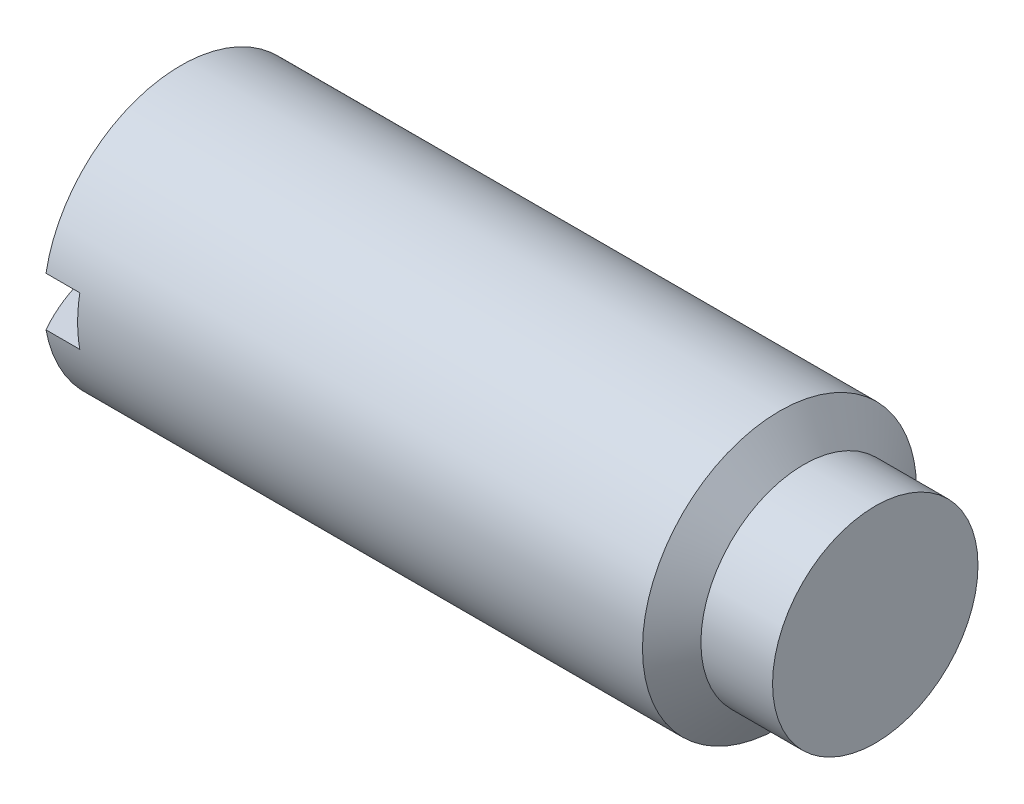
SolidWorks part; units mm, degrees
ref_plane "Plane1" through (0, 0, 0) normal (0, 0, 1) x (1, 0, 0)
ref_plane "Plane2" through (0, 0, 0) normal (0, 1, 0) x (1, 0, 0)
ref_plane "Plane3" through (0, 0, 0) normal (1, 0, 0) x (0, 0, -1)
sketch "BodySke" plane through (0, 0, 0) normal (0, 0, 1) x (1, 0, 0)
  line L0 (2.5522, -9.525) -> (19.05, -9.525) construction
  line L1 (45.8216, 7.1374) -> (50.8, 7.1374)
  line L2 (2.5522, 9.525) -> (44.1498, 9.525)
  line L3 (45.8216, 7.1374) -> (44.1498, 9.525)
  line L4 (50.8, 0) -> (0, 0)
  line L5 (-12.7, 0) -> (88.9, 0) construction
  line L6 (2.0066, 12.7) -> (2.0066, -3.175) construction
  line L7 (50.8, 7.1374) -> (50.8, 0)
  line L8 (45.8216, -7.1374) -> (50.8, -7.1374) construction
  arc A1 (2.5522, 9.525) -> (0, 0) centre (19.05, 0) ccw
  dimension "D1" = 125
  dimension "Crown_radius" = 19.05
  dimension "Length" = 50.8
  dimension "Diameter" = 19.05
  dimension "Dog_dia" = 14.2748
  dimension "Dog_len" = 4.9784
  dimension "Advance" = 2.0066
revolve "BaseBody" add sketch "BodySke" angle 360 about L5
sketch "Sketch2" plane through (0, 0, 0) normal (1, 0, 0) x (0, 0, -1)
  line L1 (9.525, -1.7018) -> (-9.525, -1.7018)
  line L2 (9.525, -1.7018) -> (9.525, 1.7018)
  line L3 (9.525, 1.7018) -> (-9.525, 1.7018)
  line L4 (-9.525, -1.7018) -> (-9.525, 1.7018)
  dimension "D1" = 19.05
  dimension "D2" = 1.7018
  dimension "Slot_width" = 3.4036
  dimension "D3" = 9.525
extrude "Slot" cut sketch "Sketch2" along normal blind 4.9022
sketch "ThdSchSke" plane through (0, 0, 0) normal (0, 0, 1) x (1, 0, 0)
  line L0 (2.5522, -8.0124) -> (1.4931, -9.525)
  line L1 (2.5522, -8.0124) -> (3.6113, -9.525)
  line L2 (3.6113, -9.525) -> (3.6113, -11.9063)
  line L3 (-3.175, 0) -> (5.1513, 0) construction
  line L4 (2.5522, -9.525) -> (2.5522, -1.7018) construction
  line L5 (3.6113, -11.9063) -> (1.4931, -11.9063)
  line L6 (1.4931, -11.9063) -> (1.4931, -9.525)
  dimension "Thread_minor" = 16.0249
  dimension "Diameter" = 19.05
  dimension "SideAngle" = 55
  dimension "VeeAngle" = 70
  dimension "Overcut" = 23.8125
revolve "ThreadSchematic" [suppressed] cut sketch "ThdSchSke" angle 360 about L3
pattern_linear "ThdSchPat" [suppressed]
equation "\"D1@Sketch2\" = \"Diameter@BodySke\""
equation "\"D3@Sketch2\" = \"D1@Sketch2\" / 2"
equation "\"D2@Sketch2\" = \"Slot_width@Sketch2\" / 2"
equation "\"Thread_minor@ThdSchSke\" = \"Thread_minor@ThreadCosmetic\""
equation "\"Diameter@ThdSchSke\" = \"Diameter@BodySke\""
equation "\"Overcut@ThdSchSke\" = \"Diameter@BodySke\" * 1.25"
equation "\"Num_threads@ThdSchPat\" = int ( ( \"Length@BodySke\" - ( \"Crown_radius@BodySke\" - sqr ( ( \"Crown_radius@BodySke\" * \"Crown_radius@BodySke\" ) - ( ( \"Diameter@BodySke\" * 0.5 ) * ( \"Diameter@BodySke\" * 0.5 "
equation "\"Advance@ThdSchPat\" = ( \"Length@BodySke\" - ( \"Crown_radius@BodySke\" - sqr ( ( \"Crown_radius@BodySke\" * \"Crown_radius@BodySke\" ) - ( ( \"Diameter@BodySke\" * 0.5 ) * ( \"Diameter@BodySke\" * 0.5 ) ) ) ) - "
equation "\"Num_threads@ThdSchPat\" = \"Num_threads@ThdSchPat\" - sgn( \"Num_threads@ThdSchPat\" - 1) '---chamfered tips only---"
